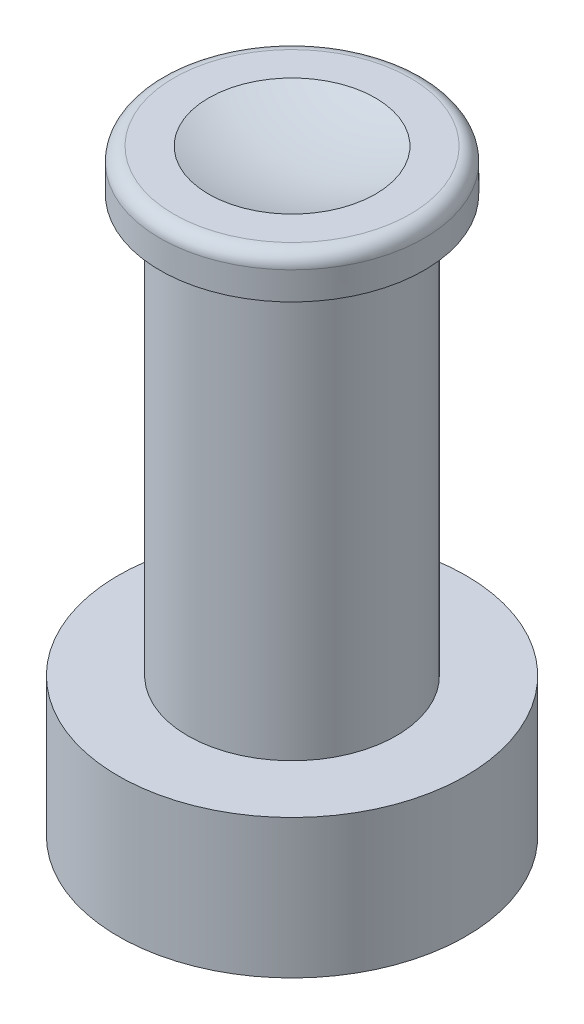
SolidWorks part; units mm, degrees
ref_plane "Front Plane" through (0, 0, 0) normal (0, 0, 1) x (1, 0, 0)
ref_plane "Top Plane" through (0, 0, 0) normal (0, 1, 0) x (1, 0, 0)
ref_plane "Right Plane" through (0, 0, 0) normal (1, 0, 0) x (0, 0, -1)
sketch "Sketch1" plane through (0, 0, 0) normal (0, 1, 0) x (1, 0, 0)
  circle A0 centre (0, 0) radius 1.905
  dimension "D1" = 3.81
extrude "Extrude1" add sketch "Sketch1" against normal blind 7.62
sketch "Sketch2" plane through (0, 0, 0) normal (0, 1, 0) x (1, 0, 0)
  circle A0 centre (0, 0) radius 2.413
  dimension "D1" = 4.826
extrude "Extrude2" add sketch "Sketch2" along normal blind 0.762
sketch "Sketch3" plane through (0, -7.62, 0) normal (0, -1, 0) x (1, 0, 0)
  circle A0 centre (0, 0) radius 3.175
  dimension "D1" = 6.35
extrude "Extrude3" add sketch "Sketch3" along normal blind 2.54
fillet "Fillet1" radius 0.254 1 edges at (0, 0.762, 2.413)
sketch "Sketch4" plane through (0, 0, 0) normal (0, 0, 1) x (1, 0, 0)
  line L0 (0, 0) -> (0, 2.1529) construction
  line L1 (-2.413, 0.508) -> (2.413, 0.508) construction
  line L2 (2.159, 0.762) -> (-2.159, 0.762) construction
  line L3 (0, 0.508) -> (0, 0.762)
  line L4 (0, 0.762) -> (1.524, 0.762)
  arc A0 (0, 0.508) -> (1.524, 0.762) centre (0, 5.207) ccw
  dimension "D1" = 2.1529
  dimension "D3" = 1.524
revolve "Cut-Revolve1" cut sketch "Sketch4" angle 360 about L0
